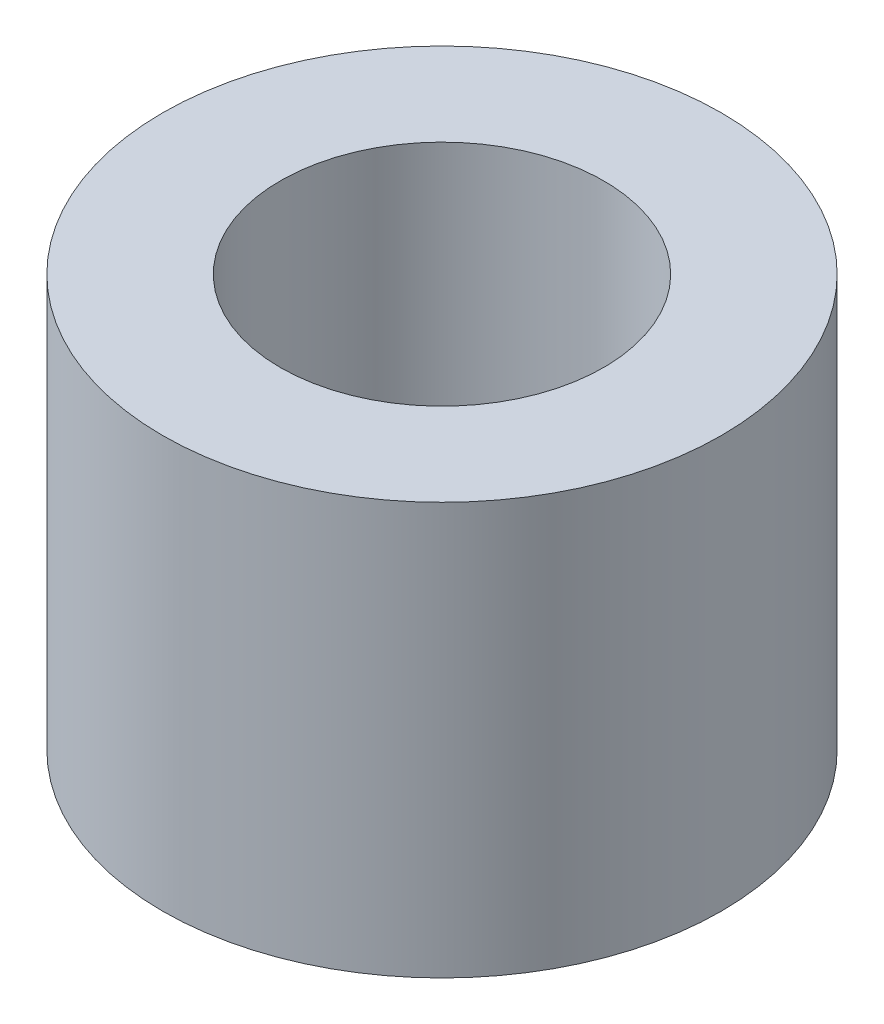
SolidWorks part; units mm, degrees
ref_plane "Front Plane" through (0, 0, 0) normal (0, 0, 1) x (1, 0, 0)
ref_plane "Top Plane" through (0, 0, 0) normal (0, 1, 0) x (1, 0, 0)
ref_plane "Right Plane" through (0, 0, 0) normal (1, 0, 0) x (0, 0, -1)
sketch "Sketch1" plane through (0, 0, 0) normal (0, 1, 0) x (1, 0, 0)
  circle A0 centre (0, 0) radius 15.0749
  circle A1 centre (0, 0) radius 8.7249
  dimension "D1" = 17.4498
  dimension "D2" = 30.1498
extrude "Boss-Extrude1" add sketch "Sketch1" along normal blind 22.225
